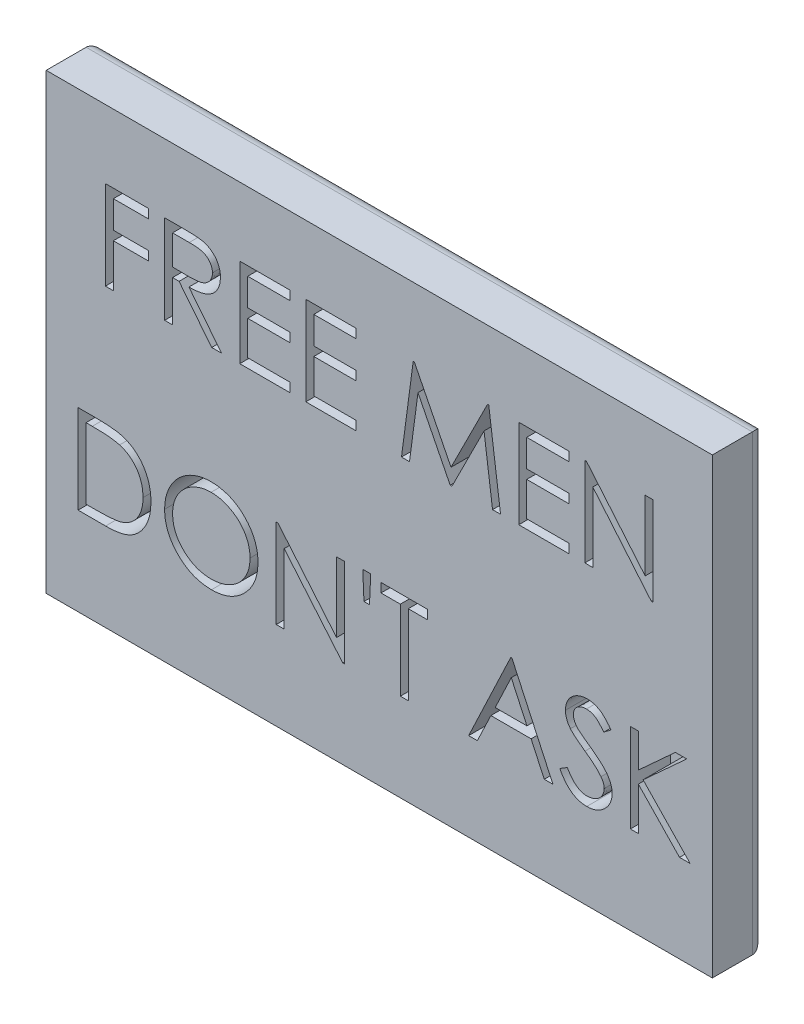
SolidWorks part; units mm, degrees
ref_plane "Front Plane" through (0, 0, 0) normal (0, 0, 1) x (1, 0, 0)
ref_plane "Top Plane" through (0, 0, 0) normal (0, 1, 0) x (1, 0, 0)
ref_plane "Right Plane" through (0, 0, 0) normal (1, 0, 0) x (0, 0, -1)
sketch "Sketch1" plane through (0, 0, 0) normal (0, 0, 1) x (1, 0, 0)
  line L1 (-15.875, -10.795) -> (15.875, -10.795)
  line L2 (-15.875, -10.795) -> (-15.875, 10.795)
  line L3 (-15.875, 10.795) -> (15.875, 10.795)
  line L4 (15.875, -10.795) -> (15.875, 10.795)
  line L5 (-15.875, -10.795) -> (15.875, 10.795) construction
  line L6 (-15.875, 10.795) -> (15.875, -10.795) construction
  point P0 (0, 0)
  dimension "D1" = 31.75
  dimension "D2" = 21.59
extrude "Boss-Extrude1" add sketch "Sketch1" along normal blind 2.54
fillet "Fillet1" radius 0.635 4 edges at (-15.875, 0, 0) (0, -10.795, 0) (0, 10.795, 0) (15.875, 0, 0)
sketch "Sketch2" plane through (0, 0, 2.54) normal (0, 0, 1) x (1, 0, 0)
  line L0 (-15.875, 10.795) -> (-14.977, 9.897) construction
  line L1 (-14.977, 9.897) -> (-14.977, 6.598) construction
  line L2 (-14.977, 6.598) -> (-14.977, 3.299) construction
  line L3 (-14.977, 3.299) -> (-14.977, 0) construction
  line L4 (-14.977, 0) -> (-14.977, -3.299) construction
  line L5 (-14.977, -3.299) -> (-14.977, -6.598) construction
  line L6 (-14.977, -6.598) -> (-14.977, -9.897) construction
  line L7 (-14.977, -9.897) -> (-15.875, -10.795) construction
  line L8 (15.875, 10.795) -> (-15.875, 10.795) construction
  line L9 (-15.875, -10.795) -> (15.875, -10.795) construction
  line L10 (-14.977, -9.897) -> (14.977, -9.897) construction
  line L11 (14.977, -9.897) -> (15.875, -10.795) construction
  line L12 (14.977, -9.897) -> (14.977, -6.598) construction
  line L13 (14.977, -6.598) -> (14.977, -3.299) construction
  line L14 (14.977, -3.299) -> (14.977, 0) construction
  line L15 (14.977, 0) -> (14.977, 3.299) construction
  line L16 (14.977, 3.299) -> (14.977, 6.598) construction
  line L17 (14.977, 6.598) -> (14.977, 9.897) construction
  line L18 (14.977, 9.897) -> (15.875, 10.795) construction
  line L19 (-14.977, 9.897) -> (14.977, 9.897) construction
  line L20 (-14.977, 6.598) -> (14.977, 6.598) construction
  line L21 (-14.977, 3.299) -> (14.977, 3.299) construction
  line L22 (-14.977, 0) -> (14.977, 0) construction
  line L23 (-14.977, -3.299) -> (14.977, -3.299) construction
  line L24 (-14.977, -6.598) -> (14.977, -6.598) construction
  text T0 "FREE MEN" font "Century Gothic" height in points 16
  text T1 "DON'T ASK" font "Century Gothic" height in points 16
  dimension "D1" = 45
  dimension "D2" = 45
  dimension "D3" = 1.27
extrude "Cut-Extrude1" cut sketch "Sketch2" against normal blind 1.905
